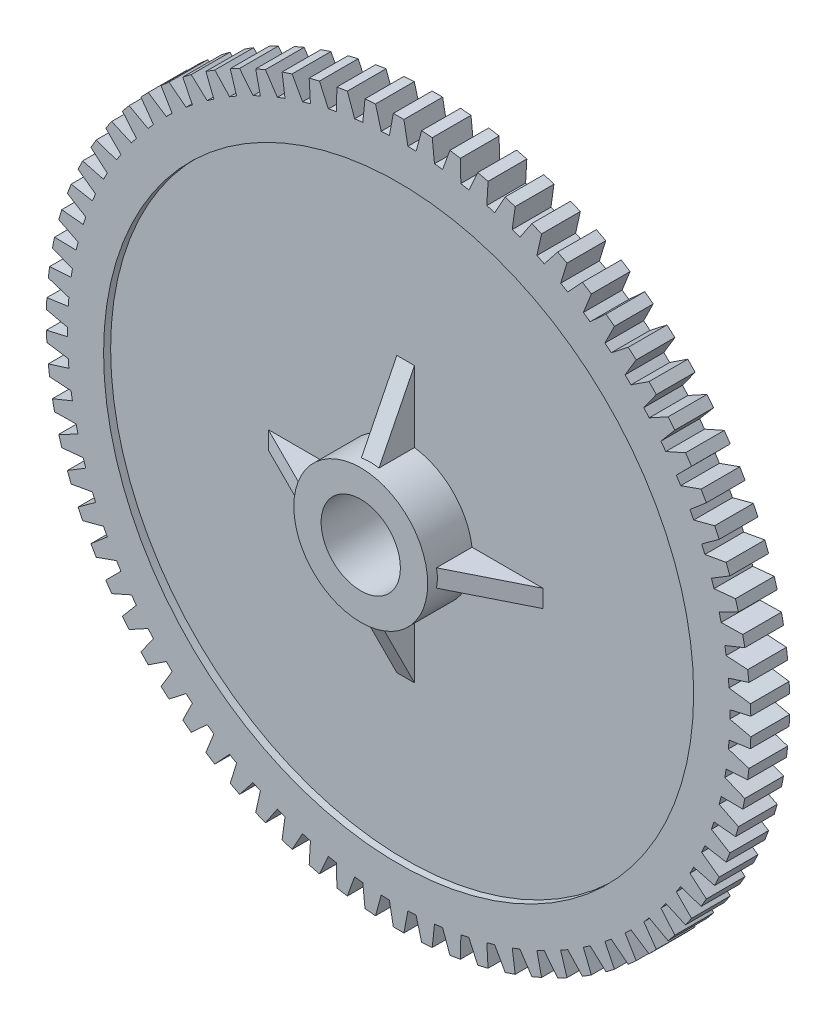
SolidWorks part; units mm, degrees
ref_plane "Plane1" through (0, 0, 0) normal (0, 0, 1) x (1, 0, 0)
ref_plane "Plane2" through (0, 0, 0) normal (0, 1, 0) x (1, 0, 0)
ref_plane "Plane3" through (0, 0, 0) normal (1, 0, 0) x (0, 0, -1)
sketch "Sketch1" plane through (0, 0, 0) normal (0, 0, 1) x (1, 0, 0)
  line L0 (0, -46.9007) -> (0, 46.1463) construction
  line L1 (1.05, 37.5853) -> (0.6, 39.9955)
  line L2 (-1.05, 37.5853) -> (-0.6, 39.9955)
  line L3 (-0.6, 39.9955) -> (0.6, 39.9955)
  line L4 (-1.05, 37.5853) -> (1.05, 37.5853)
  circle A0 centre (0, 0) radius 40 construction
  circle A1 centre (0, 0) radius 37.6 construction
  dimension "D1" = 80
  dimension "D2" = 75.2
  dimension "D3" = 2.1
  dimension "D4" = 1.2
sketch "Sketch2" plane through (0, 0, 0) normal (0, 0, 1) x (1, 0, 0)
  circle A0 centre (0, 0) radius 37.6 construction
  circle A1 centre (0, 0) radius 37.6
extrude "tooth profile" add sketch "Sketch1" along normal blind 4.4
extrude "gear body" add sketch "Sketch2" along normal blind 4.4
pattern_circular "tooth copies" count 78 every 4.615 about axis through (0, 0, 0) along (0, 0, 1) of "tooth profile"
sketch "Sketch3" plane through (0, 0, 4.4) normal (0, 0, 1) x (1, 0, 0)
  circle A0 centre (0, 0) radius 33.5
  dimension "D1" = 67
extrude "top relief" cut sketch "Sketch3" against normal blind 0.8
sketch "Sketch4" plane through (0, 0, 0) normal (0, 0, -1) x (-1, 0, 0)
  circle A0 centre (0, 0) radius 33.5
  dimension "D1" = 67
extrude "bottom relief" cut sketch "Sketch4" against normal blind 0.8
sketch "Sketch5" plane through (0, 0, 0.8) normal (0, 0, -1) x (-1, 0, 0)
  circle A0 centre (0, 0) radius 7.5
  dimension "D1" = 15
extrude "bottom boss" add sketch "Sketch5" along normal blind 0.5
sketch "Sketch6" plane through (0, 0, 3.6) normal (0, 0, 1) x (1, 0, 0)
  circle A0 centre (0, 0) radius 7.6
  dimension "D1" = 15.2
extrude "top boss" add sketch "Sketch6" along normal blind 5.1
sketch "Sketch9" plane through (0, 0, 0) normal (1, 0, 0) x (0, 0, -1)
  line L2 (-3.6, 15.6) -> (-7.6, 7.6)
  dimension "D1" = 8
  dimension "D2" = 4
rib "boss rib" sketch "Sketch9" sketch "Sketch9" thickness 2 extrusion direction parallel to sketch draft on no parameters "D1"=2
pattern_circular "copy boss ribs" count 4 every 90 about axis through (0, 0, 0) along (0, 0, 1) of "boss rib"
sketch "Sketch10" plane through (0, 0, 8.7) normal (0, 0, 1) x (1, 0, 0)
  circle A0 centre (0, 0) radius 4.5
  dimension "D1" = 9
extrude "Cut-Extrude1" cut sketch "Sketch10" against normal through all
equation "\"result\"= 0.127367"
equation "\"result\"= 1*36.470000"
equation "\"result\"= 1.000000*36.470000"
